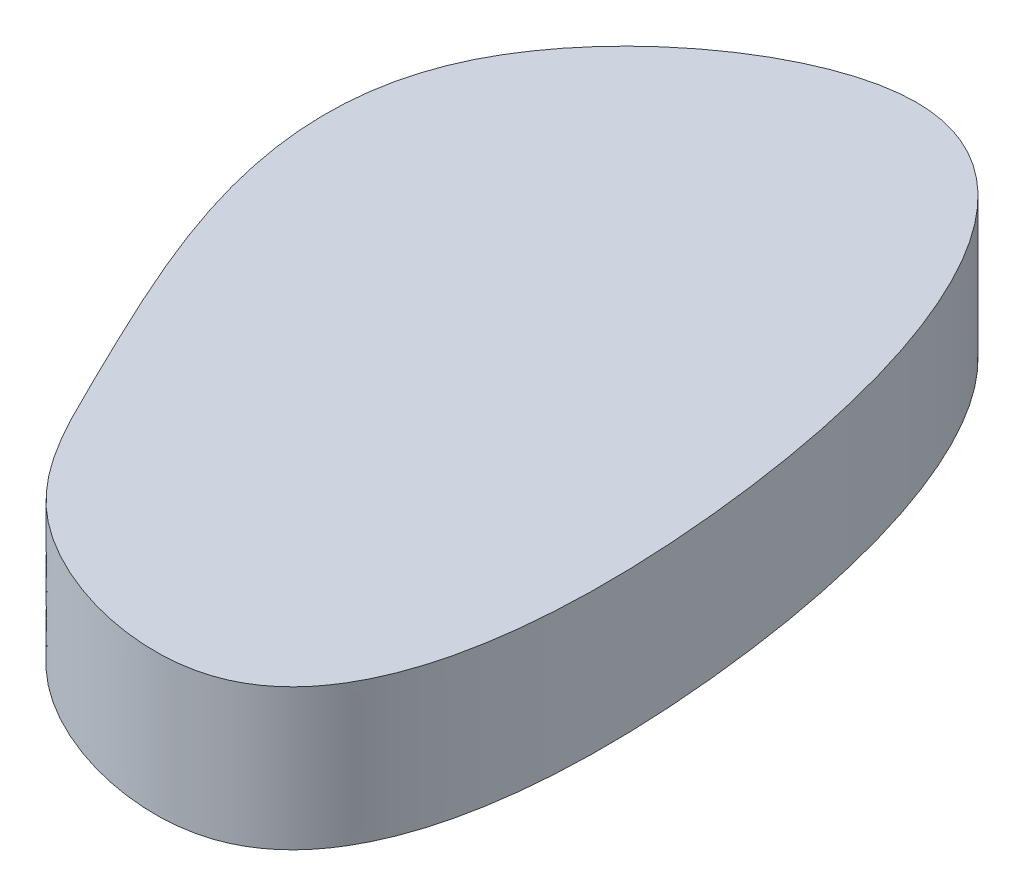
SolidWorks part; units mm, degrees
ref_plane "Front Plane" through (0, 0, 0) normal (0, 0, 1) x (1, 0, 0)
ref_plane "Top Plane" through (0, 0, 0) normal (0, 1, 0) x (1, 0, 0)
ref_plane "Right Plane" through (0, 0, 0) normal (1, 0, 0) x (0, 0, -1)
sketch "Sketch1" plane through (0, 0, 0) normal (0, 1, 0) x (1, 0, 0)
  spline S0 degree 3 poles (16.7514, -34.8667) (-8.2932, 17.5564) (-43.9039, 87.999) (55.101, 161.1341) (94.8702, 49.7134) (84.961, -53.8442) (16.7514, -34.8667) (-8.2932, 17.5564) (-43.9039, 87.999) knots -0.379253 -0.185867 -0.081625 0 0.223212 0.372718 0.620747 0.814133 0.918375 1 1.223212 1.372718 1.620747 only from (0, 0) to (0, 0)
extrude "Extrude1" add sketch "Sketch1" along normal mid plane 28.702
sketch "Sketch2" plane through (0, 14.351, 0) normal (0, 1, 0) x (-1, 0, 0)
  spline S0 degree 3 poles (-68.3343, 28.5712) (-68.2899, -46.7277) (-60.8387, -89.4659) (-8.0523, -112.3968) (5.8208, -48.5695) (-12.1155, -10.3056) (-68.3343, 28.5712) (-68.2899, -46.7277) (-60.8387, -89.4659) knots -0.555561 -0.342382 -0.222785 0 0.148126 0.283693 0.444439 0.657618 0.777215 1 1.148126 1.283693 1.444439 only from (-66.3266, -48.9383) to (-66.3266, -48.9383)
sketch "Sketch3" plane through (0, -14.351, 0) normal (0, -1, 0) x (1, 0, 0)
  spline S2 degree 3 number of poles 159 (-5.08, -58.4325) -> (-5.08, -58.4325)
  spline S3 degree 3 number of poles 159 (-5.08, -58.4325) -> (-5.08, -58.4325)
  dimension "D1" = 5.08
sketch "Sketch4" plane through (0, 0, 0) normal (0, 1, 0) x (1, 0, 0)
  spline S0 degree 3 poles (69.6783, 62.5439) (9.963, 103.0654) (-1.5127, 32.4164) (55.3606, -8.6674) (69.6783, 62.5439) (9.963, 103.0654) (-1.5127, 32.4164) knots -0.740733 -0.503569 -0.243023 0 0.259267 0.496431 0.756977 1 1.259267 1.496431 1.756977 only from (18.6142, 84.7226) to (18.6142, 84.7226)
